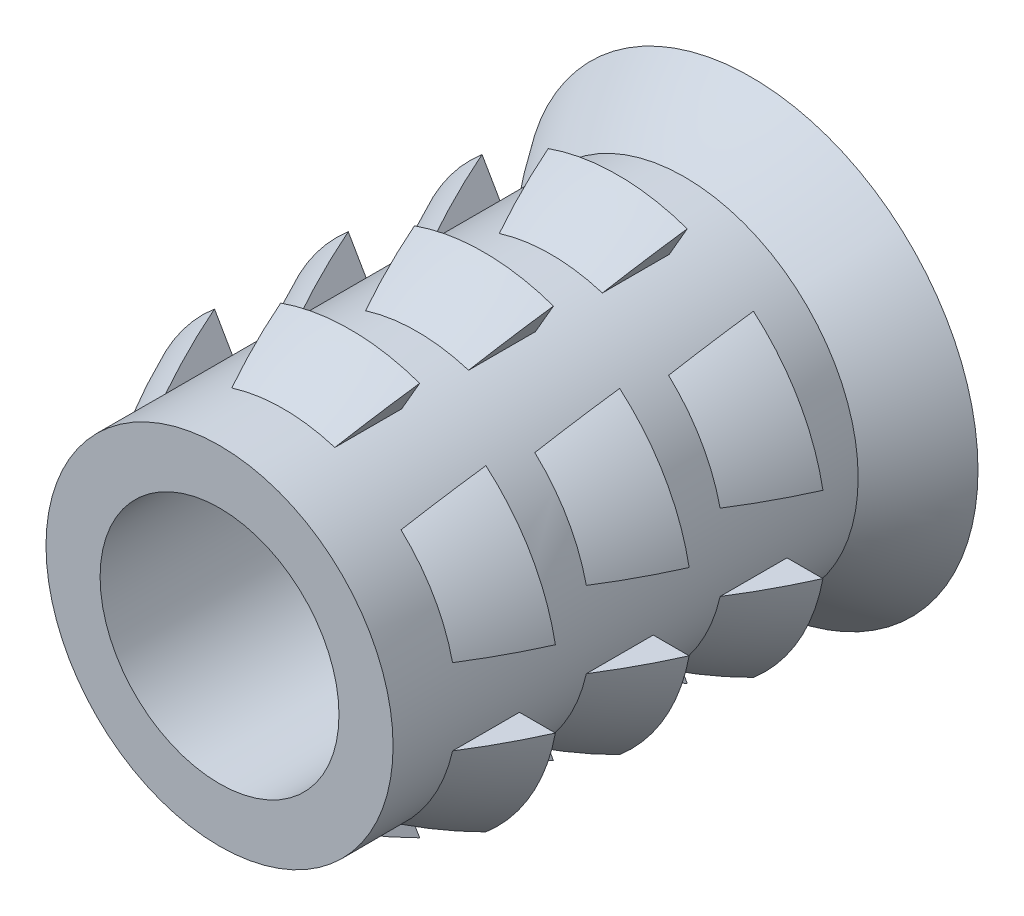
SolidWorks part; units mm, degrees
other "<insert M3x0.5(3005S6-7)>-<CirPattern1>"
ref_plane "Front Plane" through (0, 0, 0) normal (0, 0, 1) x (1, 0, 0)
ref_plane "Top Plane" through (0, 0, 0) normal (0, 1, 0) x (1, 0, 0)
ref_plane "Right Plane" through (0, 0, 0) normal (1, 0, 0) x (0, 0, -1)
inserted part "insert M3x0.5(3005S6-7)"
